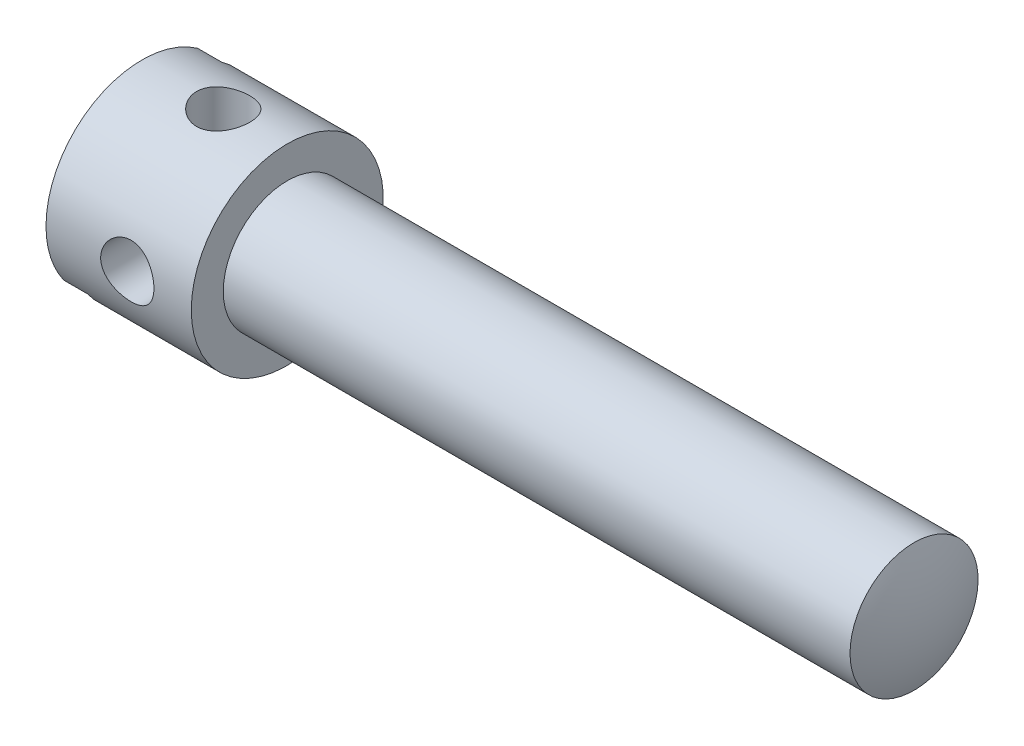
SolidWorks part; units mm, degrees
ref_plane "Front" through (0, 0, 0) normal (0, 0, 1) x (1, 0, 0)
ref_plane "Top" through (0, 0, 0) normal (0, 1, 0) x (1, 0, 0)
ref_plane "Right" through (0, 0, 0) normal (1, 0, 0) x (0, 0, -1)
sketch "Sketch1" plane through (0, 0, 0) normal (0, 0, 1) x (1, 0, 0)
  line L0 (-25.0595, 0) -> (22.8592, 0) construction
  line L1 (1.1515, 7.5) -> (12.5, 7.5)
  line L2 (0, 0) -> (12.5, 0)
  line L4 (12.5, 7.5) -> (12.5, 0)
  arc A0 (1.1515, 7.5) -> (0, 0) centre (25, 0) ccw
  dimension "R" = 25
  dimension "k" = 12.5
  dimension "dk" = 15
revolve "BaseHead" add sketch "Sketch1" angle 360 about L0
sketch "Sketch2" plane through (12.5, 3.6143, 0.1956) normal (1, 0, 0) x (0, 0, -1)
  circle A0 centre (0.1956, -3.6143) radius 5
  dimension "d" = 10
extrude "Neck" add sketch "Sketch2" along normal blind 50
sketch "Sketch3" plane through (62.5, 0.8938, 2.2293) normal (1, 0, 0) x (0, 0, -1)
  circle A0 centre (2.2293, -0.8938) radius 5
  dimension "d" = 10
sketch "Sketch4" plane through (0, 0, 0) normal (0, 0, 1) x (1, 0, 0)
  line L0 (61.4142, 0) -> (-35.076, 0) construction
  line L1 (62.5, -5) -> (62.5, 5) construction
  line L3 (62.5, 0) -> (62.5, 5) construction
  line L4 (50, 12.5) -> (50, 17.5)
  line L5 (50, 17.5) -> (67.5, 17.5)
  line L6 (67.5, 17.5) -> (67.5, 0)
  line L7 (67.5, 0) -> (62.5, 0)
  arc A0 (62.5, 0) -> (50, 12.5) centre (50, 0) ccw
  dimension "D3" = 12.5
  dimension "D1" = 5
  dimension "D2" = 5
revolve "Cut-Revolve1" cut sketch "Sketch4" angle 360 about L0
sketch "Sketch5" plane through (0, 0, 0) normal (0, 0, 1) x (1, 0, 0)
  line L0 (12.5, -7.5) -> (12.5, 7.5) construction
  circle A0 centre (7.5, 0) radius 2.08
extrude "Cut-Extrude1" cut sketch "Sketch5" against normal mid plane 140
sketch "Sketch6" plane through (0, 0, 0) normal (0, 1, 0) x (1, 0, 0)
  line L0 (12.5, -7.5) -> (12.5, 7.5) construction
  circle A0 centre (7.5, 0) radius 2.08
extrude "Cut-Extrude2" cut sketch "Sketch6" against normal mid plane 140
ref_plane "Plane1" through (0, 0, 0) normal (0, -0.7071, 0.7071) x (1, 0, 0)
sketch "Sketch7" plane through (0, 0, 0) normal (0, -0.7071, 0.7071) x (1, 0, 0)
  line L0 (0, 0) -> (-23.3893, 0) construction
  line L1 (0, 1.25) -> (3, 1.25)
  line L2 (0, 1.25) -> (0, -1.25)
  line L3 (0, -1.25) -> (3, -1.25)
  line L4 (3, 1.25) -> (3, -1.25)
  line L6 (1.1515, 7.5) -> (1.1515, -7.5) construction
  arc A1 (0, 0) -> (1.1515, -7.5) centre (25, 0) ccw construction
extrude "Cut-Extrude3" cut sketch "Sketch7" against normal mid plane 140
sketch "Sketch8" plane through (0, 0, 0) normal (0, 1, 0) x (1, 0, 0)
  line L0 (0, 0) -> (-28.8801, 0) construction
  line L2 (0, 1.25) -> (3, 1.25)
  line L3 (0, 1.25) -> (0, -1.25)
  line L4 (0, -1.25) -> (3, -1.25)
  line L5 (3, 1.25) -> (3, -1.25)
extrude "Cut-Extrude4" [suppressed] cut sketch "Sketch8" against normal mid plane 140
sketch "Sketch9" plane through (0, 0, 0) normal (0, 0, 1) x (1, 0, 0)
  line L0 (61.4564, 4.3505) -> (61.8314, 5)
  line L1 (61.8314, 5) -> (61.8314, 5.75)
  line L2 (61.8314, 5.75) -> (61.0814, 5.75)
  line L3 (61.0814, 5.75) -> (61.0814, 5)
  line L4 (61.0814, 5) -> (61.4564, 4.3505)
  line L5 (0, 0) -> (68.448, 0) construction
  line L7 (61.4564, 5) -> (61.4564, -5) construction
  dimension "D1" = 10
  dimension "D2" = 0.75
revolve "Cut-Revolve10" [suppressed] cut sketch "Sketch9" angle 360 about L5
pattern_linear "LPattern10" [suppressed] count 33 spacing 0.9 along (1, 0, 0)
equation "\"D3@Sketch4\" = \"R@Sketch1\"  / 2"
equation "\"D1@Sketch9\" = \"d@Sketch2\""
equation "\"D2@Sketch9\" =  ( \"d@Sketch2\" - \"D2@ThreadCosmetic1\" )  / 2"
equation "\"D3@LPattern10\" = \"D2@Sketch9\" * 1.2"
equation "\"D1@LPattern10\" = \"D1@ThreadCosmetic1\" / \"D3@LPattern10\""
